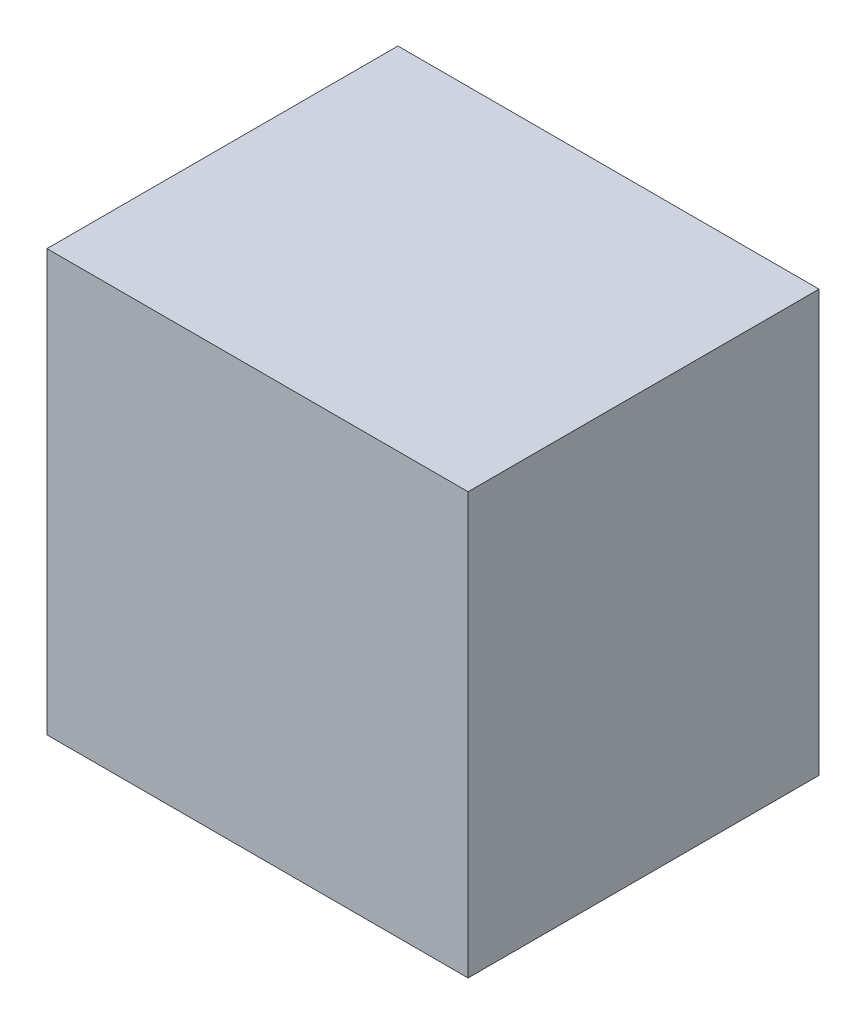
SolidWorks part; units mm, degrees
ref_plane "Front Plane" through (0, 0, 0) normal (0, 0, 1) x (1, 0, 0)
ref_plane "Top Plane" through (0, 0, 0) normal (0, 1, 0) x (1, 0, 0)
ref_plane "Right Plane" through (0, 0, 0) normal (1, 0, 0) x (0, 0, -1)
sketch "Sketch1" plane through (0, 0, 0) normal (0, 0, 1) x (1, 0, 0)
  line L1 (0, 0) -> (120, 0)
  line L2 (0, 0) -> (0, 120)
  line L3 (0, 120) -> (120, 120)
  line L4 (120, 0) -> (120, 120)
  dimension "D1" = 120
  dimension "D2" = 120
extrude "Boss-Extrude1" add sketch "Sketch1" along normal blind 100
